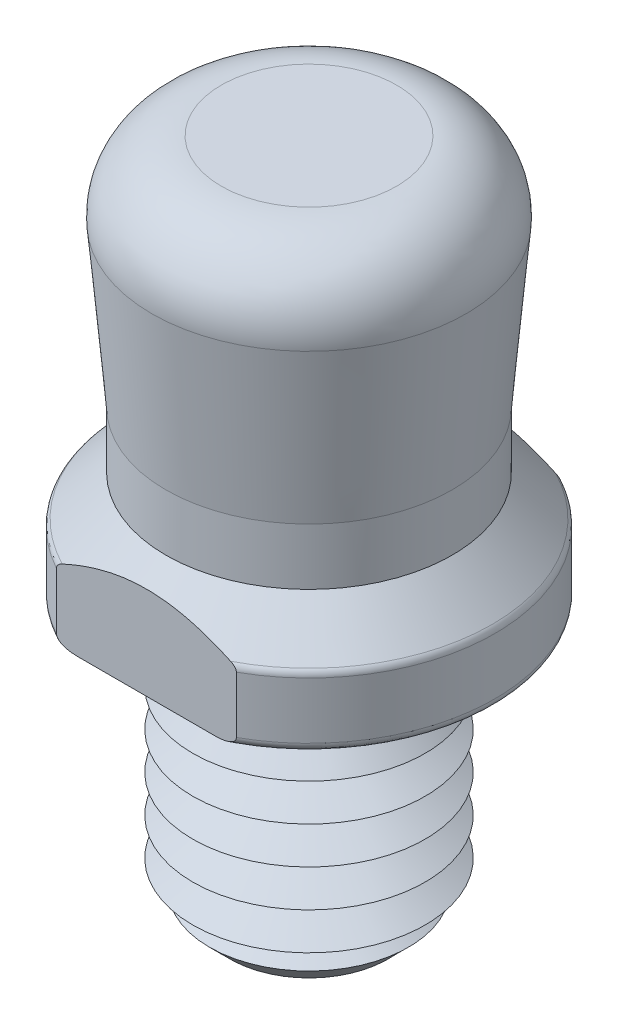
SolidWorks part; units mm, degrees
ref_plane "Front Plane" through (0, 0, 0) normal (0, 0, 1) x (1, 0, 0)
ref_plane "Top Plane" through (0, 0, 0) normal (0, 1, 0) x (1, 0, 0)
ref_plane "Right Plane" through (0, 0, 0) normal (1, 0, 0) x (0, 0, -1)
sketch "Sketch1" plane through (0, 0, 0) normal (1, 0, 0) x (0, 0, -1)
  line L0 (0, 69.5403) -> (0, -60.8671) construction
sketch "Sketch2" plane through (0, 0, 0) normal (1, 0, 0) x (0, 0, -1)
  line L0 (0, 0) -> (-3.8, 0)
  line L1 (-4, 0.2) -> (-4, 1.4172)
  line L2 (-3.9414, 1.5586) -> (-3.0808, 2.4192)
  line L3 (-3.0808, 2.4192) -> (-3.0808, 3.6364)
  line L4 (-3.0808, 3.6364) -> (-3.3811, 7.0693)
  line L5 (-1.8868, 8.7) -> (0, 8.7)
  line L6 (0, 69.5403) -> (0, -60.8671) construction
  line L7 (0, 8.7) -> (0, 0)
  arc A0 (-3.3811, 7.0693) -> (-1.8868, 8.7) centre (-1.8868, 7.2) cw
  arc A1 (-4, 1.4172) -> (-3.9414, 1.5586) centre (-3.8, 1.4172) cw
  arc A2 (-3.8, 0) -> (-4, 0.2) centre (-3.8, 0.2) cw
  point P14 (-4, 1.5)
  point P17 (-4, 0)
  dimension "D6" = 1.5
  dimension "D7" = 0.2
  dimension "D1" = 4
  dimension "D2" = 8.7
  dimension "D3" = 45
  dimension "D4" = 5
  dimension "D5" = 1.5
revolve "Revolve1" add sketch "Sketch2" angle 360 about L0
sketch "Sketch4" plane through (0, 0, 0) normal (0, 1, 0) x (1, 0, 0)
  line L0 (-2.0481, -3.5) -> (2.0481, -3.5)
  line L2 (2.0481, 3.5) -> (-2.0481, 3.5)
  arc A0 (-2.0481, -3.5) -> (2.0481, -3.5) centre (0, 0) ccw
  arc A1 (2.0481, 3.5) -> (-2.0481, 3.5) centre (0, 0) ccw
  dimension "D1" = 7
extrude "Cut-Extrude1" cut sketch "Sketch4" along normal blind 2
sketch "Sketch5" plane through (0, 0, 0) normal (1, 0, 0) x (0, 0, -1)
  line L0 (0, 0) -> (-1.9343, 0)
  line L1 (-3.5, 0) -> (3.5, 0) construction
  line L2 (-1.9343, 0) -> (-1.9343, -1)
  line L3 (-1.9343, -1) -> (-2.5, -1.5657)
  line L4 (-2.5, -1.5657) -> (-2.5, -5.8)
  line L5 (-2.5, -5.8) -> (0, -5.8)
  line L6 (0, 69.5403) -> (0, -60.8671) construction
  line L7 (0, -5.8) -> (0, 0)
  dimension "D1" = 2.5
  dimension "D2" = 5.8
  dimension "D3" = 1
  dimension "D4" = 45
  dimension "D5" = 0.8
revolve "Revolve3" add sketch "Sketch5" angle 360 about L0
chamfer "Chamfer2" distance 0.8 angle 45 1 edges at (0, -5.8, 2.5)
sketch "Sketch6" plane through (0, 0, 0) normal (1, 0, 0) x (0, 0, -1)
  line L0 (-2.5, -1.5657) -> (-1.8072, -1.9657)
  line L1 (-1.8072, -1.9657) -> (-2.5, -2.3657)
  line L2 (-2.5, -1.5657) -> (-2.5, -5) construction
  line L3 (-2.5, -2.3657) -> (-2.5, -1.5657)
  dimension "D1" = 0.8
revolve "Cut-Revolve1" cut sketch "Sketch6" angle 360 about L0
pattern_linear "LPattern1" count 6 spacing 0.8 along (0, -1, 0) of "Cut-Revolve1"
